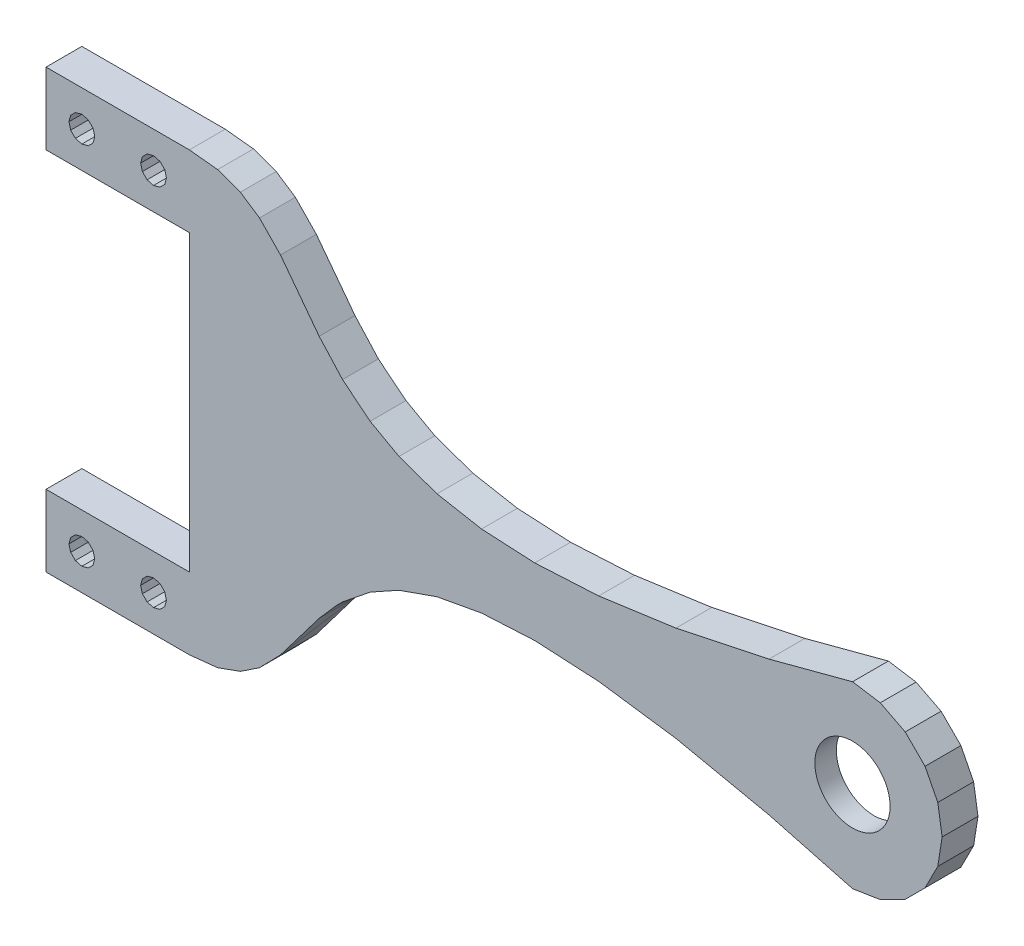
SolidWorks part; units mm, degrees
ref_plane "Plan de face" through (0, 0, 0) normal (0, 0, 1) x (1, 0, 0)
ref_plane "Plan de dessus" through (0, 0, 0) normal (0, 1, 0) x (1, 0, 0)
ref_plane "Plan de droite" through (0, 0, 0) normal (1, 0, 0) x (0, 0, -1)
imported_body "Importée3"
sketch "Esquisse1" plane through (20, 0, 0) normal (-1, 0, 0) x (0, 0, 1)
  line L0 (5, 0) -> (0, 0)
  line L1 (0, 0) -> (0, 61)
  line L2 (0, 61) -> (5, 61)
  line L3 (5, 61) -> (5, 0)
extrude "Boss.-Extru.1" add sketch "Esquisse1" along normal blind 20
sketch "Esquisse2" plane through (0, 0, 5) normal (0, 0, 1) x (1, 0, 0)
  line L0 (0, 10) -> (20, 10)
  line L1 (20, 10) -> (20, 51)
  line L2 (20, 51) -> (0, 51)
  line L3 (0, 51) -> (0, 10)
extrude "Enlèv. mat.-Extru.1" cut sketch "Esquisse2" against normal through all
sketch "Esquisse3" plane through (0, 0, 0) normal (0, 0, -1) x (-1, 0, 0)
  line L0 (-5, 57.8) -> (-5.9, 57.5588)
  line L1 (-5.9, 57.5588) -> (-6.5588, 56.9)
  line L2 (-6.5588, 56.9) -> (-6.8, 56)
  line L3 (-6.8, 56) -> (-6.5588, 55.1)
  line L4 (-6.5588, 55.1) -> (-5.9, 54.4412)
  line L5 (-5.9, 54.4412) -> (-5, 54.2)
  line L6 (-5, 54.2) -> (-4.1, 54.4412)
  line L7 (-4.1, 54.4412) -> (-3.4412, 55.1)
  line L8 (-3.4412, 55.1) -> (-3.2, 56)
  line L9 (-3.2, 56) -> (-3.4412, 56.9)
  line L10 (-3.4412, 56.9) -> (-4.1, 57.5588)
  line L11 (-4.1, 57.5588) -> (-5, 57.8)
extrude "Enlèv. mat.-Extru.2" cut sketch "Esquisse3" against normal through all
sketch "Esquisse4" plane through (0, 0, 0) normal (0, 0, -1) x (-1, 0, 0)
  line L0 (-16.5588, 55.1) -> (-15.9, 54.4412)
  line L1 (-15.9, 54.4412) -> (-15, 54.2)
  line L2 (-15, 54.2) -> (-14.1, 54.4412)
  line L3 (-14.1, 54.4412) -> (-13.4412, 55.1)
  line L4 (-13.4412, 55.1) -> (-13.2, 56)
  line L5 (-13.2, 56) -> (-13.4412, 56.9)
  line L6 (-13.4412, 56.9) -> (-14.1, 57.5588)
  line L7 (-14.1, 57.5588) -> (-15, 57.8)
  line L8 (-15, 57.8) -> (-15.9, 57.5588)
  line L9 (-15.9, 57.5588) -> (-16.5588, 56.9)
  line L10 (-16.5588, 56.9) -> (-16.8, 56)
  line L11 (-16.8, 56) -> (-16.5588, 55.1)
extrude "Enlèv. mat.-Extru.3" cut sketch "Esquisse4" against normal through all
sketch "Esquisse5" plane through (0, 0, 0) normal (0, 0, -1) x (-1, 0, 0)
  line L0 (-15, 6.8) -> (-15.9, 6.5588)
  line L1 (-15.9, 6.5588) -> (-16.5588, 5.9)
  line L2 (-16.5588, 5.9) -> (-16.8, 5)
  line L3 (-16.8, 5) -> (-16.5588, 4.1)
  line L4 (-16.5588, 4.1) -> (-15.9, 3.4412)
  line L5 (-15.9, 3.4412) -> (-15, 3.2)
  line L6 (-15, 3.2) -> (-14.1, 3.4412)
  line L7 (-14.1, 3.4412) -> (-13.4412, 4.1)
  line L8 (-13.4412, 4.1) -> (-13.2, 5)
  line L9 (-13.2, 5) -> (-13.4412, 5.9)
  line L10 (-13.4412, 5.9) -> (-14.1, 6.5588)
  line L11 (-14.1, 6.5588) -> (-15, 6.8)
extrude "Enlèv. mat.-Extru.4" cut sketch "Esquisse5" against normal through all
sketch "Esquisse6" plane through (0, 0, 5) normal (0, 0, 1) x (1, 0, 0)
  line L0 (3.2, 5) -> (3.4412, 4.1)
  line L1 (3.4412, 4.1) -> (4.1, 3.4412)
  line L2 (4.1, 3.4412) -> (5, 3.2)
  line L3 (5, 3.2) -> (5.9, 3.4412)
  line L4 (5.9, 3.4412) -> (6.5588, 4.1)
  line L5 (6.5588, 4.1) -> (6.8, 5)
  line L6 (6.8, 5) -> (6.5588, 5.9)
  line L7 (6.5588, 5.9) -> (5.9, 6.5588)
  line L8 (5.9, 6.5588) -> (5, 6.8)
  line L9 (5, 6.8) -> (4.1, 6.5588)
  line L10 (4.1, 6.5588) -> (3.4412, 5.9)
  line L11 (3.4412, 5.9) -> (3.2, 5)
extrude "Enlèv. mat.-Extru.5" cut sketch "Esquisse6" against normal through all
chamfer "Chanfrein1" distance 2.3107 angle 9.903 1 edges at (47.0091, 39.3655, 2.5)
chamfer "Chanfrein2" distance 1.5422 angle 13.841 1 edges at (28.5582, 58.9232, 2.5)
chamfer "Chanfrein3" distance 2.3607 angle 9.692 1 edges at (47.0091, 21.6345, 2.5)
chamfer "Chanfrein4" distance 1.7477 angle 12.187 1 edges at (28.5582, 2.0768, 2.5)
sketch "Esquisse7" plane through (0, 0, 5) normal (0, 0, 1) x (1, 0, 0)
  line L0 (111.8973, 35.4635) -> (113.0852, 25.6807)
  line L1 (111.8973, 25.5365) -> (114.273, 25.8249) construction
  circle A0 centre (112.4912, 30.5721) radius 5.25
  point P7 (112.4912, 30.5721)
  dimension "D1" = 10.5
extrude "Enlèv. mat.-Extru.6" cut sketch "Esquisse7" against normal blind 10
